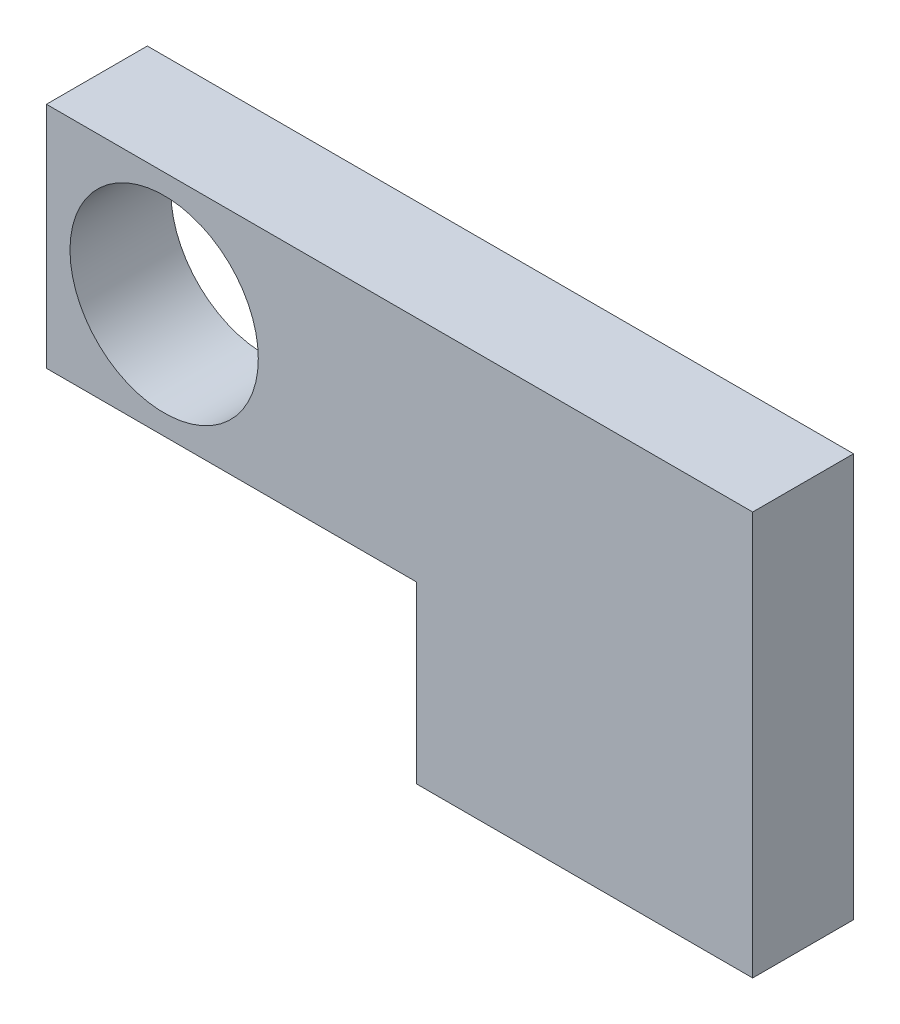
SolidWorks part; units mm, degrees
ref_plane "Plan de face" through (0, 0, 0) normal (0, 0, 1) x (1, 0, 0)
ref_plane "Plan de dessus" through (0, 0, 0) normal (0, 1, 0) x (1, 0, 0)
ref_plane "Plan de droite" through (0, 0, 0) normal (1, 0, 0) x (0, 0, -1)
sketch "Esquisse1" plane through (0, 0, 0) normal (0, 0, 1) x (1, 0, 0)
  line L0 (0, 0) -> (-50, 0)
  line L1 (-50, 0) -> (-50, 26)
  line L2 (-50, 26) -> (-105, 26)
  line L3 (-105, 26) -> (-105, 60)
  line L4 (-105, 60) -> (0, 60)
  line L5 (0, 60) -> (0, 0)
  circle A0 centre (-87.5, 43) radius 14
  dimension "D1" = 28
  dimension "D2" = 17
  dimension "D3" = 34
  dimension "D4" = 60
  dimension "D5" = 105
  dimension "D6" = 17.5
  dimension "D7" = 50
extrude "Extrusion1" add sketch "Esquisse1" along normal mid plane 15
